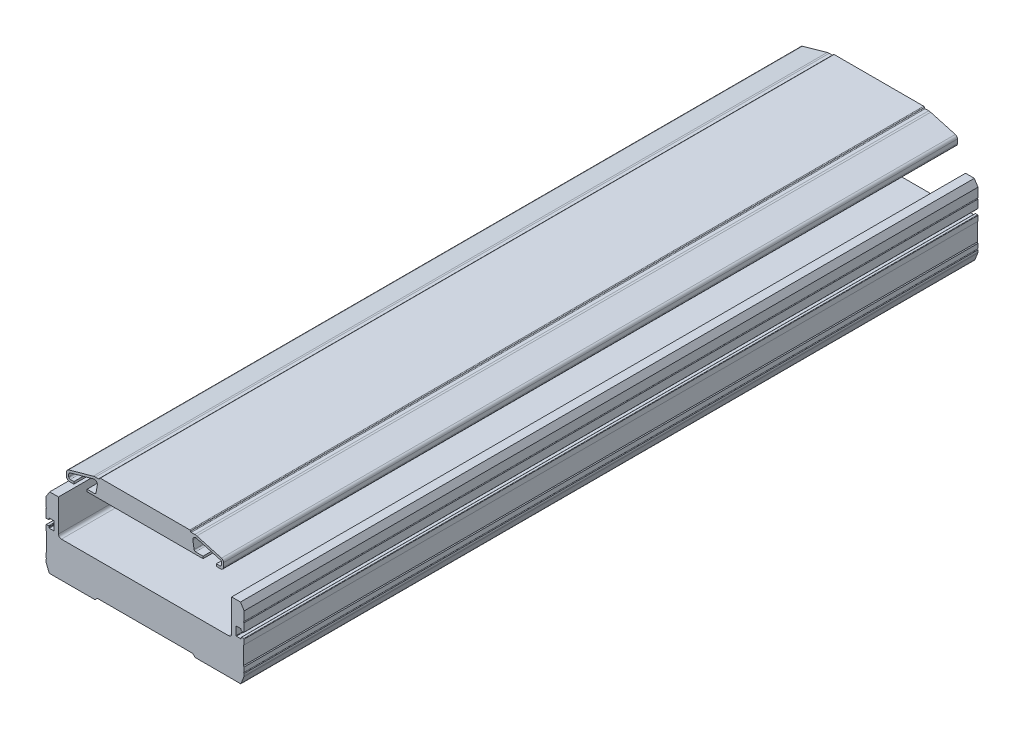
SolidWorks part; units mm, degrees
ref_plane "前视基准面" through (0, 0, 0) normal (0, 0, 1) x (1, 0, 0)
ref_plane "上视基准面" through (0, 0, 0) normal (0, 1, 0) x (1, 0, 0)
ref_plane "右视基准面" through (0, 0, 0) normal (1, 0, 0) x (0, 0, -1)
sketch "草图1" plane through (0, 0, 0) normal (0, 0, 1) x (1, 0, 0)
  line B0 (30.5, 71.9) -> (-30.5, 71.9)
  line B1 (-31.5, 70.9) -> (-33.9122, 70.9)
  line B2 (-35.2622, 70.7143) -> (-52.04, 66.0094)
  line B3 (-53.5, 64.0837) -> (-53.5, 61.4)
  line B4 (-51.5, 59.4) -> (-48.5, 59.4)
  line B5 (-48.5, 59.4) -> (-48.5, 60.9)
  line B6 (-48.5, 60.9) -> (-51, 60.9)
  line B7 (-52, 61.9) -> (-52, 63.7046)
  line B8 (-51.27, 64.6675) -> (-35.0485, 69.2164)
  line B9 (-32.5361, 66.9593) -> (-33.4138, 61.7343)
  line B10 (-34.4, 60.9) -> (-39.5, 60.9)
  line B11 (-39.5, 60.9) -> (-39.5, 59.4)
  line B12 (-39.5, 59.4) -> (39.5, 59.4)
  line B13 (39.5, 59.4) -> (39.5, 60.9)
  line B14 (39.5, 60.9) -> (34.4, 60.9)
  line B15 (33.4138, 61.7343) -> (32.5361, 66.9593)
  line B16 (35.0485, 69.2164) -> (51.27, 64.6675)
  line B17 (52, 63.7046) -> (52, 61.9)
  line B18 (51, 60.9) -> (48.5, 60.9)
  line B19 (48.5, 60.9) -> (48.5, 59.4)
  line B20 (48.5, 59.4) -> (51.5, 59.4)
  line B21 (53.5, 61.4) -> (53.5, 64.0837)
  line B22 (52.04, 66.0094) -> (35.2622, 70.7143)
  line B23 (33.9122, 70.9) -> (31.5, 70.9)
  line B24 (57, 22.7) -> (-57, 22.7)
  line B25 (-59, 24.7) -> (-59, 46.6)
  line B26 (-59, 46.6) -> (-65, 46.6)
  line B27 (-65, 46.6) -> (-67.5, 42.6)
  line B28 (-67.5, 42.6) -> (-67.5, 36.375)
  line B29 (-67.5, 35.625) -> (-67.5, 30.1)
  line B30 (-67.2, 29.8) -> (-65.8, 29.8)
  line B31 (-65.5, 30.1) -> (-65.5, 30.7)
  line B32 (-65.2, 31) -> (-62.3, 31)
  line B33 (-62, 30.7) -> (-62, 25.3)
  line B34 (-62.3, 25) -> (-65.2, 25)
  line B35 (-65.5, 25.3) -> (-65.5, 25.9)
  line B36 (-65.8, 26.2) -> (-67.2, 26.2)
  line B37 (-67.5, 25.9) -> (-67.5, 22.5)
  line B38 (-67.5, 22.5) -> (-67, 22)
  line B39 (-67, 22) -> (-67, 10)
  line B40 (-67, 10) -> (-67.5, 9.5)
  line B41 (-67.5, 9.5) -> (-67.5, 6.375)
  line B42 (-67.5, 5.625) -> (-67.5, 4.382)
  line B43 (-67.3599, 3.6465) -> (-65.5064, -1.0289)
  line B44 (-65.16, -1.6) -> (-34.1, -1.6)
  line B45 (-34.1, -1.6) -> (-32.5, 0)
  line B46 (-32.5, 0) -> (32.5, 0)
  line B47 (32.5, 0) -> (34.1, -1.6)
  line B48 (34.1, -1.6) -> (65.16, -1.6)
  line B49 (65.5064, -1.0289) -> (67.3604, 3.6478)
  line B50 (67.5, 4.3813) -> (67.5, 5.625)
  line B51 (67.5, 6.375) -> (67.5, 9.5)
  line B52 (67.5, 9.5) -> (67, 10)
  line B53 (67, 10) -> (67, 22)
  line B54 (67, 22) -> (67.5, 22.5)
  line B55 (67.5, 22.5) -> (67.5, 25.9)
  line B56 (67.2, 26.2) -> (65.8, 26.2)
  line B57 (65.5, 25.9) -> (65.5, 25.3)
  line B58 (65.2, 25) -> (62.3, 25)
  line B59 (62, 25.3) -> (62, 30.7)
  line B60 (62.3, 31) -> (65.2, 31)
  line B61 (65.5, 30.7) -> (65.5, 30.1)
  line B62 (65.8, 29.8) -> (67.2, 29.8)
  line B63 (67.5, 30.1) -> (67.5, 35.625)
  line B64 (67.5, 36.375) -> (67.5, 42.6)
  line B65 (67.5, 42.6) -> (65, 46.6)
  line B66 (65, 46.6) -> (59, 46.6)
  line B67 (59, 46.6) -> (59, 24.7)
  arc B68 (31, 71.4) -> (31.5, 70.9) centre (31.5, 71.4) ccw
  arc B69 (31, 71.4) -> (30.5, 71.9) centre (30.5, 71.4) ccw
  arc B70 (-30.5, 71.9) -> (-31, 71.4) centre (-30.5, 71.4) ccw
  arc B71 (-31.5, 70.9) -> (-31, 71.4) centre (-31.5, 71.4) ccw
  arc B72 (-33.9122, 70.9) -> (-35.2622, 70.7143) centre (-33.9122, 65.9) ccw
  arc B73 (-52.04, 66.0094) -> (-53.5, 64.0837) centre (-51.5, 64.0837) ccw
  arc B74 (-53.5, 61.4) -> (-51.5, 59.4) centre (-51.5, 61.4) ccw
  arc B75 (-52, 61.9) -> (-51, 60.9) centre (-51, 61.9) ccw
  arc B76 (-51.27, 64.6675) -> (-52, 63.7046) centre (-51, 63.7046) ccw
  arc B77 (-32.5361, 66.9593) -> (-35.0485, 69.2164) centre (-34.5085, 67.2906) ccw
  arc B78 (-34.4, 60.9) -> (-33.4138, 61.7343) centre (-34.4, 61.9) ccw
  arc B79 (33.4138, 61.7343) -> (34.4, 60.9) centre (34.4, 61.9) ccw
  arc B80 (35.0485, 69.2164) -> (32.5361, 66.9593) centre (34.5085, 67.2906) ccw
  arc B81 (52, 63.7046) -> (51.27, 64.6675) centre (51, 63.7046) ccw
  arc B82 (51, 60.9) -> (52, 61.9) centre (51, 61.9) ccw
  arc B83 (51.5, 59.4) -> (53.5, 61.4) centre (51.5, 61.4) ccw
  arc B84 (53.5, 64.0837) -> (52.04, 66.0094) centre (51.5, 64.0837) ccw
  arc B85 (35.2622, 70.7143) -> (33.9122, 70.9) centre (33.9122, 65.9) ccw
  arc B86 (-59, 24.7) -> (-57, 22.7) centre (-57, 24.7) ccw
  arc B87 (-67.5, 35.625) -> (-67.5, 36.375) centre (-67.5, 36) ccw
  arc B88 (-67.5, 30.1) -> (-67.2, 29.8) centre (-67.2, 30.1) ccw
  arc B89 (-65.8, 29.8) -> (-65.5, 30.1) centre (-65.8, 30.1) ccw
  arc B90 (-65.2, 31) -> (-65.5, 30.7) centre (-65.2, 30.7) ccw
  arc B91 (-62, 30.7) -> (-62.3, 31) centre (-62.3, 30.7) ccw
  arc B92 (-62.3, 25) -> (-62, 25.3) centre (-62.3, 25.3) ccw
  arc B93 (-65.5, 25.3) -> (-65.2, 25) centre (-65.2, 25.3) ccw
  arc B94 (-65.5, 25.9) -> (-65.8, 26.2) centre (-65.8, 25.9) ccw
  arc B95 (-67.2, 26.2) -> (-67.5, 25.9) centre (-67.2, 25.9) ccw
  arc B96 (-67.5, 5.625) -> (-67.5, 6.375) centre (-67.5, 6) ccw
  arc B97 (-67.5, 4.382) -> (-67.3599, 3.6465) centre (-65.5, 4.382) ccw
  arc B98 (-65.5064, -1.0289) -> (-65.16, -1.6) centre (-63.6472, -0.2918) ccw
  arc B99 (65.16, -1.6) -> (65.5064, -1.0289) centre (63.6472, -0.2918) ccw
  arc B100 (67.3604, 3.6478) -> (67.5, 4.3813) centre (65.5, 4.382) ccw
  arc B101 (67.5, 6.375) -> (67.5, 5.625) centre (67.5, 6) ccw
  arc B102 (67.5, 25.9) -> (67.2, 26.2) centre (67.2, 25.9) ccw
  arc B103 (65.8, 26.2) -> (65.5, 25.9) centre (65.8, 25.9) ccw
  arc B104 (65.2, 25) -> (65.5, 25.3) centre (65.2, 25.3) ccw
  arc B105 (62, 25.3) -> (62.3, 25) centre (62.3, 25.3) ccw
  arc B106 (62.3, 31) -> (62, 30.7) centre (62.3, 30.7) ccw
  arc B107 (65.5, 30.7) -> (65.2, 31) centre (65.2, 30.7) ccw
  arc B108 (65.5, 30.1) -> (65.8, 29.8) centre (65.8, 30.1) ccw
  arc B109 (67.2, 29.8) -> (67.5, 30.1) centre (67.2, 30.1) ccw
  arc B110 (67.5, 36.375) -> (67.5, 35.625) centre (67.5, 36) ccw
  arc B111 (57, 22.7) -> (59, 24.7) centre (57, 24.7) ccw
sketch_block_instance "块2-1"
sketch_block "块2"
extrude "凸台-拉伸1" add sketch "草图1" along normal blind 500
hole_wizard "打孔尺寸(%根据)内六角圆柱头螺钉的类型1" positions "草图7" profile "草图5" counterbore size "M6" standard "GB"
sketch "草图7" plane through (0, 46.6, 0) normal (0, 1, 0) x (1, 0, 0)
  line L0 (0, 0) -> (0, -383.8232) construction
  line L2 (30.5, 0) -> (-30.5, 0) construction
  point P0 (-53, -61.5)
  point P8 (-53, -161.5)
  point P10 (-53, -961.5)
  point P12 (-53, -561.5)
  point P14 (-53, -361.5)
  point P16 (-53, -1161.5)
  point P18 (-53, -761.5)
  point P34 (53, -761.5)
  point P35 (53, -1161.5)
  point P36 (53, -361.5)
  point P37 (53, -561.5)
  point P38 (53, -961.5)
  point P39 (53, -161.5)
  point P40 (53, -61.5)
  dimension "D1" = 106
  dimension "D2" = 61.5
  dimension "D3" = 100
  dimension "D4" = 200
  dimension "D5" = 200
  dimension "D6" = 200
  dimension "D7" = 200
  dimension "D8" = 200
sketch "草图5" plane through (-53, 46.6, 61.5) normal (1, 0, 0) x (0, 0, 1)
  line L0 (0, 0) -> (0, 48.2)
  line L1 (0, 48.2) -> (3.5, 48.2)
  line L3 (3.5, 48.2) -> (3.5, 40.9)
  line L4 (3.5, 40.9) -> (5.5, 40.9)
  line L5 (5.5, 40.9) -> (5.5, 0)
  line L7 (5.5, 0) -> (0, 0)
  line L11 (0, -6.35) -> (0, 107.95) construction
  dimension "通孔孔直径" = 7
  dimension "通孔孔深度" = 48.2
  dimension "柱形沉头孔直径" = 11
  dimension "柱形沉头孔深度" = 40.9
hole_wizard "M6 螺纹孔1" positions "草图8" profile "草图9" tap size "M6" standard "GB"
sketch "草图8" plane through (0, -1.6, 0) normal (0, -1, 0) x (-1, 0, 0)
  line L0 (0, 0) -> (0, -43.6644) construction
  line L2 (-34.1, 0) -> (-65.16, 0) construction
  point P0 (-53, -51.5)
  point P7 (53, -51.5)
  point P10 (-53, -151.5)
  point P12 (-53, -351.5)
  point P14 (-53, -551.5)
  point P18 (-53, -751.5)
  point P20 (-53, -951.5)
  point P21 (53, -951.5)
  point P22 (53, -751.5)
  point P23 (53, -551.5)
  point P24 (53, -351.5)
  point P25 (53, -151.5)
  point P28 (-53, -1151.5)
  point P34 (53, -1151.5)
  dimension "D1" = 106
  dimension "D2" = 51.5
  dimension "D3" = 100
  dimension "D4" = 200
  dimension "D5" = 200
  dimension "D6" = 200
  dimension "D7" = 200
  dimension "D8" = 200
sketch "草图9" plane through (53, -1.6, 51.5) normal (1, 0, 0) x (0, 0, -1)
  line L0 (0, 0) -> (0, 12.5022)
  line L1 (0, 12.5022) -> (2.5, 11)
  line L2 (2.5, 11) -> (2.5, 0)
  line L5 (2.5, 0) -> (0, 0)
  line L10 (0, 12.5022) -> (-2.5, 11) construction
  line L11 (0, -6.35) -> (0, 107.95) construction
  dimension "螺纹孔钻头直径" = 5
  dimension "螺纹孔钻头深度" = 11
  dimension "导头角度" = 118
